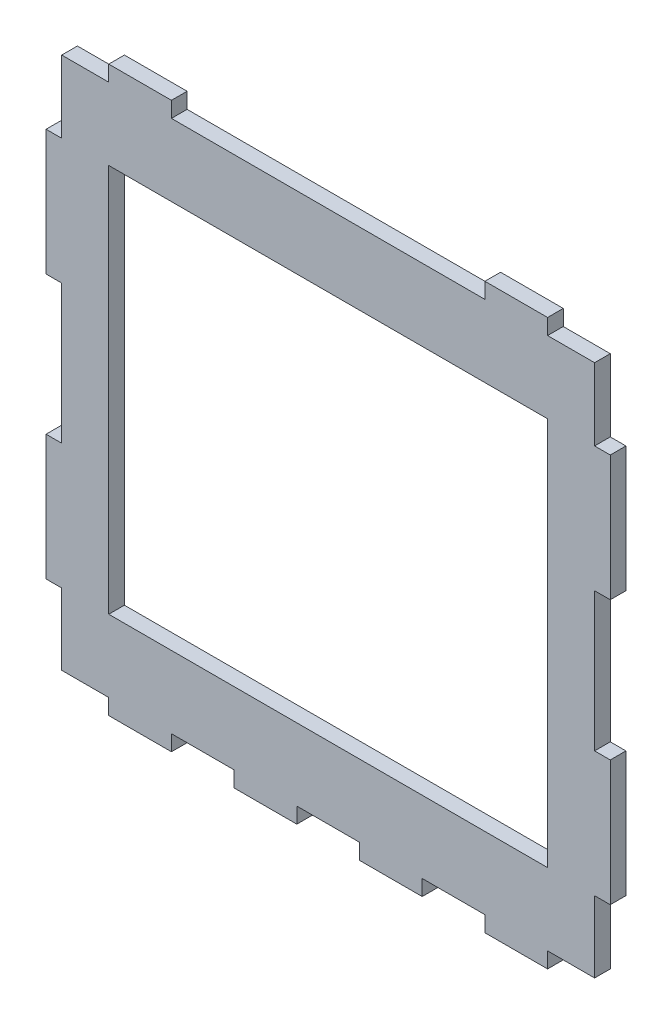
SolidWorks part; units mm, degrees
ref_plane "Front Plane" through (0, 0, 0) normal (0, 0, 1) x (1, 0, 0)
ref_plane "Top Plane" through (0, 0, 0) normal (0, 1, 0) x (1, 0, 0)
ref_plane "Right Plane" through (0, 0, 0) normal (1, 0, 0) x (0, 0, -1)
sketch "Sketch1" plane through (0, 0, 0) normal (0, 0, 1) x (1, 0, 0)
  line L0 (-101.6, 114.3) -> (-101.6, 111.125)
  line L1 (0, 0) -> (-114.3, 0)
  line L2 (0, 0) -> (0, 114.3)
  line L3 (0, 114.3) -> (-114.3, 114.3)
  line L4 (-114.3, 0) -> (-114.3, 114.3)
  line L5 (-101.6, 111.125) -> (-88.9, 111.125)
  line L6 (-88.9, 111.125) -> (-88.9, 114.3)
  line L7 (-57.15, 114.3) -> (-57.15, 0) construction
  line L8 (-25.4, 111.125) -> (-25.4, 114.3)
  line L9 (-12.7, 114.3) -> (-12.7, 111.125)
  line L10 (-12.7, 111.125) -> (-25.4, 111.125)
  line L11 (-101.6, 0) -> (-101.6, 3.175)
  line L12 (-101.6, 3.175) -> (-88.9, 3.175)
  line L13 (-88.9, 3.175) -> (-88.9, 0)
  line L14 (-88.9, 0) -> (-88.9, 3.175)
  line L15 (-88.9, 3.175) -> (-76.2, 3.175)
  line L16 (-76.2, 3.175) -> (-76.2, 0)
  line L17 (-76.2, 0) -> (-76.2, 3.175)
  line L18 (-76.2, 3.175) -> (-63.5, 3.175)
  line L19 (-63.5, 3.175) -> (-63.5, 0)
  line L20 (-63.5, 0) -> (-63.5, 3.175)
  line L21 (-63.5, 3.175) -> (-50.8, 3.175)
  line L22 (-50.8, 3.175) -> (-50.8, 0)
  line L23 (-50.8, 0) -> (-50.8, 3.175)
  line L24 (-50.8, 3.175) -> (-38.1, 3.175)
  line L25 (-38.1, 3.175) -> (-38.1, 0)
  line L26 (-38.1, 0) -> (-38.1, 3.175)
  line L27 (-38.1, 3.175) -> (-25.4, 3.175)
  line L28 (-25.4, 3.175) -> (-25.4, 0)
  line L29 (-25.4, 0) -> (-25.4, 3.175)
  line L30 (-25.4, 3.175) -> (-12.7, 3.175)
  line L31 (-12.7, 3.175) -> (-12.7, 0)
  line L32 (-101.6, 3.175) -> (-114.3, 3.175)
  line L33 (-12.7, 3.175) -> (0, 3.175)
  line L34 (-89.2817, 111.125) -> (-25.4, 111.125)
  line L35 (-101.6, 96.52) -> (-12.7, 96.52)
  line L36 (-101.6, 96.52) -> (-101.6, 17.78)
  line L37 (-101.6, 17.78) -> (-12.7, 17.78)
  line L38 (-12.7, 96.52) -> (-12.7, 17.78)
  line L39 (-101.6, 111.125) -> (-114.3, 111.125)
  line L40 (-114.3, 111.125) -> (-114.3, 114.3)
  line L41 (-12.7, 111.125) -> (0, 111.125)
  line L42 (0, 111.125) -> (0, 114.3)
  dimension "D1" = 114.3
  dimension "D2" = 114.3
  dimension "D3" = 12.7
  dimension "D4" = 3.175
  dimension "D5" = 12.7
  dimension "D6" = 12.7
  dimension "D7" = 3.175
  dimension "D8" = 12.7
  dimension "D10" = 12.7
  dimension "D11" = 17.78
  dimension "D12" = 12.7
  dimension "D13" = 17.78
  dimension "D9" = 7
extrude "Boss-Extrude1" add sketch "Sketch1" along normal blind 3.175 contours L7 L3 L6 L5 L0 L4 L1 | L13 L12 L11 L1 | L19 L18 L16 L1 | L25 L24 L22 L1 | L31 L30 L28 L1 | L3 L7 L21 L24 L27 L30 L33 L2 L9 L10 L8 | L5 L6 L3 L0 | L10 L9 L3 L8
sketch "Sketch2" plane through (0, 0, 3.175) normal (0, 0, 1) x (1, 0, 0)
  line L0 (-57.15, 111.125) -> (-57.15, 3.175) construction
  line L1 (-88.9, 111.125) -> (-25.4, 111.125) construction
  line L2 (-50.8, 3.175) -> (-63.5, 3.175) construction
  line L5 (-101.6, 96.52) -> (-12.7, 96.52) construction
  line L6 (-114.3, 96.52) -> (-111.125, 96.52)
  line L7 (-114.3, 3.175) -> (-114.3, 111.125) construction
  line L8 (-111.125, 96.52) -> (-111.125, 71.12)
  line L9 (-111.125, 71.12) -> (-114.3, 71.12)
  line L10 (-114.3, 71.12) -> (-114.3, 96.52)
  line L11 (-114.3, 111.125) -> (-101.6, 111.125) construction
  line L14 (-111.125, 43.02) -> (-114.3, 43.02)
  line L15 (-111.125, 17.62) -> (-111.125, 43.02)
  line L16 (-114.3, 17.62) -> (-111.125, 17.62)
  line L17 (-114.3, 43.02) -> (-114.3, 17.62)
  line L18 (-3.175, 17.62) -> (-3.175, 43.02)
  line L19 (0, 17.62) -> (-3.175, 17.62)
  line L20 (0, 43.02) -> (0, 17.62)
  line L21 (-3.175, 43.02) -> (0, 43.02)
  line L22 (-3.175, 71.12) -> (0, 71.12)
  line L23 (-3.175, 96.52) -> (-3.175, 71.12)
  line L24 (0, 96.52) -> (-3.175, 96.52)
  line L25 (0, 71.12) -> (0, 96.52)
  line L26 (-111.125, 111.125) -> (-111.125, 3.175)
  line L27 (-101.6, 3.175) -> (-114.3, 3.175) construction
  line L28 (-111.125, 3.175) -> (-114.3, 3.175)
  line L29 (-114.3, 3.175) -> (-114.3, 111.125)
  line L30 (-114.3, 111.125) -> (-111.125, 111.125)
  line L31 (0, 3.175) -> (0, 111.125)
  line L32 (-3.175, 3.175) -> (0, 3.175)
  line L33 (-3.175, 111.125) -> (-3.175, 3.175)
  line L34 (0, 111.125) -> (-3.175, 111.125)
  dimension "D1" = 14.605
  dimension "D2" = 40.005
  dimension "D3" = 3.175
  dimension "D4" = 25.4
  dimension "D5" = 28.1
  dimension "D6" = 25.4
  dimension "D7" = 3.175
extrude "Cut-Extrude1" cut sketch "Sketch2" against normal through all contours L26 L6 M19 M20 | L26 L9 L14 M20 | L26 L16 M20 M21 | L19 L33 M37 M38 | L22 L33 L21 M38 | L33 L24 M39 M38
